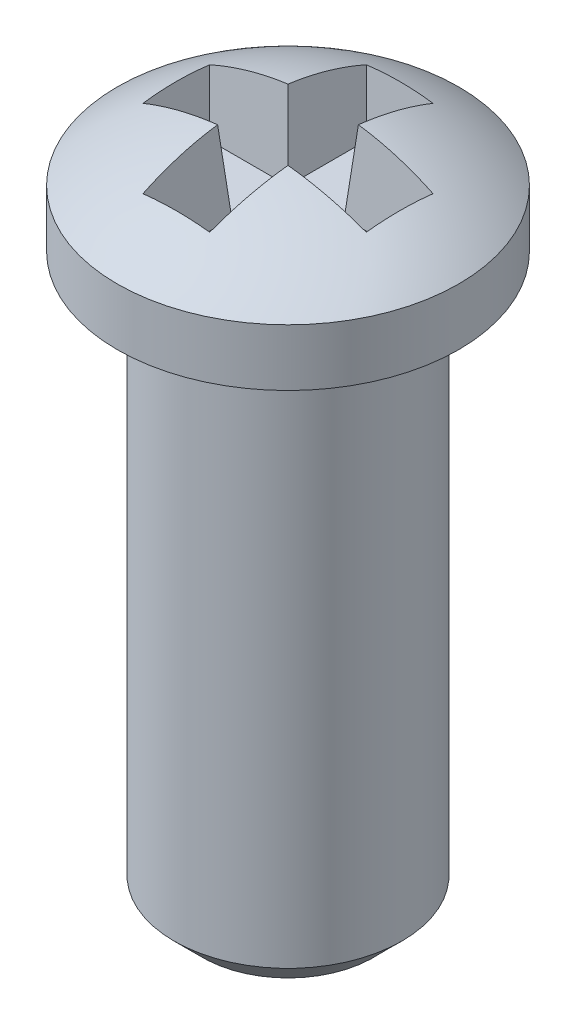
SolidWorks part; units mm, degrees
ref_plane "Front Plane" through (0, 0, 0) normal (0, 0, 1) x (1, 0, 0)
ref_plane "Top Plane" through (0, 0, 0) normal (0, 1, 0) x (1, 0, 0)
ref_plane "Right Plane" through (0, 0, 0) normal (1, 0, 0) x (0, 0, -1)
sketch "Sketch1" plane through (0, 0, 0) normal (1, 0, 0) x (0, 0, -1)
  line L0 (0, 0) -> (0, -20.0931) construction
  line L1 (0, 0) -> (-2, 0)
  line L2 (-2, 0) -> (-2, 10)
  line L3 (-2, 10) -> (-3, 10)
  line L4 (-3, 10) -> (-3, 11)
  line L5 (0, 12) -> (0, 0)
  line L6 (0, 12) -> (6.0922, 12) construction
  arc A0 (-3, 11) -> (0, 12) centre (0, 7) cw
  dimension "D1" = 4
  dimension "D2" = 10
  dimension "D3" = 6
  dimension "D4" = 1
  dimension "D5" = 1
revolve "Revolve1" add sketch "Sketch1" angle 360 about L0
chamfer "Chamfer1" distance 0.5 angle 45 1 edges at (0, 0, 2)
ref_plane "Plane1" through (0, 12, 0) normal (0, 1, 0) x (-1, 0, 0)
sketch "Sketch2" plane through (0, 12, 0) normal (0, 1, 0) x (-1, 0, 0)
  line L0 (-2, 0.625) -> (-0.625, 0.625)
  line L1 (-0.625, -2) -> (0.625, -2)
  line L2 (-0.625, -2) -> (-0.625, 2) construction
  line L3 (-0.625, 2) -> (0.625, 2)
  line L4 (0.625, -2) -> (0.625, 2) construction
  line L5 (-0.625, -2) -> (0.625, 2) construction
  line L6 (-0.625, 2) -> (0.625, -2) construction
  line L7 (2, -0.625) -> (-2, -0.625) construction
  line L8 (2, -0.625) -> (2, 0.625)
  line L9 (2, 0.625) -> (-2, 0.625) construction
  line L10 (-2, -0.625) -> (-2, 0.625)
  line L11 (2, -0.625) -> (-2, 0.625) construction
  line L12 (2, 0.625) -> (-2, -0.625) construction
  line L13 (-0.625, 0.625) -> (-0.625, 2)
  line L14 (0.625, 2) -> (0.625, 0.625)
  line L15 (0.625, 0.625) -> (2, 0.625)
  line L16 (2, -0.625) -> (0.625, -0.625)
  line L17 (0.625, -0.625) -> (0.625, -2)
  line L18 (-0.625, -2) -> (-0.625, -0.625)
  line L19 (-0.625, -0.625) -> (-2, -0.625)
  point P0 (0, 0)
  point P6 (0, 0)
  dimension "D1" = 1.25
  dimension "D2" = 1.25
  dimension "D3" = 4
  dimension "D4" = 4
extrude "Cut-Extrude1" cut sketch "Sketch2" against normal blind 1.5 draft 5
